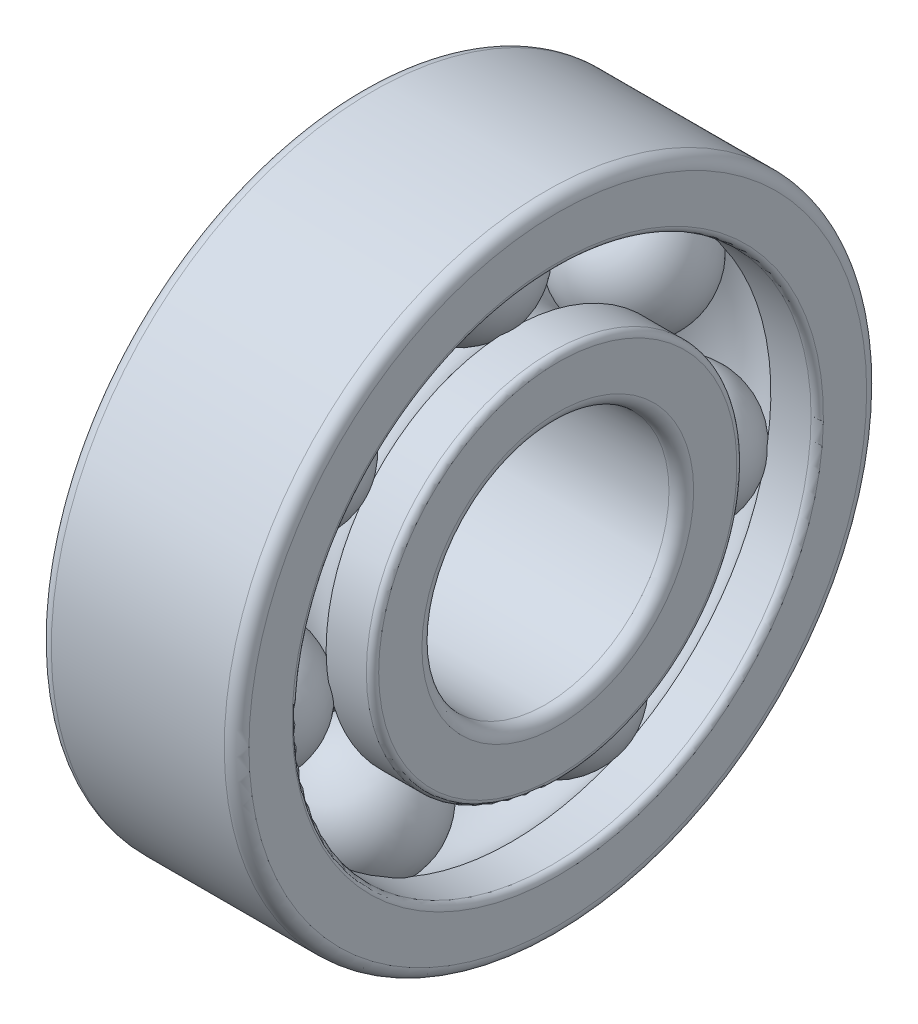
SolidWorks part; units mm, degrees
ref_plane "Plan1" through (0, 0, 0) normal (0, 0, 1) x (1, 0, 0)
ref_plane "Plan2" through (0, 0, 0) normal (0, 1, 0) x (1, 0, 0)
ref_plane "Plan3" through (0, 0, 0) normal (1, 0, 0) x (0, 0, -1)
sketch "Esquisse1" plane through (0, 0, 0) normal (0, 0, 1) x (1, 0, 0)
  line L0 (0, 0) -> (70, 0) construction
  line L1 (-3.5, 5) -> (3.5, 5)
  line L2 (-4, 5.5) -> (-4, 7.25)
  line L3 (3.75, 7.5) -> (2.1237, 7.5)
  line L4 (4, 7.25) -> (4, 5.5)
  line L9 (-2.1237, 7.5) -> (-3.75, 7.5)
  arc A0 (-4, 5.5) -> (-3.5, 5) centre (-3.5, 5.5) ccw
  arc A1 (-2.1237, 7.5) -> (2.1237, 7.5) centre (0, 9) ccw
  arc A2 (4, 5.5) -> (3.5, 5) centre (3.5, 5.5) cw
  arc A3 (-3.75, 7.5) -> (-4, 7.25) centre (-3.75, 7.25) ccw
  arc A4 (4, 7.25) -> (3.75, 7.5) centre (3.75, 7.25) ccw
  dimension "D5" = 0.5
  dimension "D6" = 0.25
  dimension "D7" = 2.6
  dimension "D1" = 7.5
  dimension "D2" = 5
  dimension "D3" = 4
  dimension "D4" = 8
  dimension "D8" = 9
revolve "Base-Révolution" add sketch "Esquisse1" angle 360 about L0
sketch "Esquisse2" plane through (0, 0, 0) normal (0, 0, 1) x (1, 0, 0)
  line L0 (0, 9) -> (5, 9) construction
  line L1 (2.65, 9) -> (-2.65, 9)
  arc A0 (-2.65, 9) -> (2.65, 9) centre (0, 9) ccw
  dimension "D1" = 2.65
  dimension "D2" = 9
revolve "Boss.-Révol.2" add sketch "Esquisse2" angle 360 about L0
pattern_circular "Répétition circulaire1" count 7 every 51.429 about axis through (0, 0, 0) along (1, 0, 0)
sketch "Esquisse3" plane through (-10, -15, 0) normal (0, 0, 1) x (1, 0, 0)
  line L0 (10, 15) -> (10, 27.5) construction
  line L5 (10, 15) -> (20, 15) construction
  line L6 (10, 15) -> (80, 15) construction
  line L7 (7.8763, 25.5) -> (6.25, 25.5)
  line L8 (14, 25.75) -> (14, 27.5)
  line L9 (13.75, 25.5) -> (12.1237, 25.5)
  line L10 (6, 27.5) -> (6, 25.75)
  line L11 (6.5, 28) -> (13.5, 28)
  arc A0 (6.5, 28) -> (6, 27.5) centre (6.5, 27.5) ccw
  arc A1 (14, 27.5) -> (13.5, 28) centre (13.5, 27.5) ccw
  arc A2 (6.25, 25.5) -> (6, 25.75) centre (6.25, 25.75) cw
  arc A3 (14, 25.75) -> (13.75, 25.5) centre (13.75, 25.75) cw
  arc A8 (7.8763, 25.5) -> (12.1237, 25.5) centre (10, 24) cw
  dimension "D5" = 2.6
  dimension "D6" = 0.5
  dimension "D7" = 0.25
  dimension "D1" = 13
  dimension "D2" = 2.5
  dimension "D3" = 4
  dimension "D4" = 8
revolve "Boss.-Révol.3" add sketch "Esquisse3" angle 360 about L5
